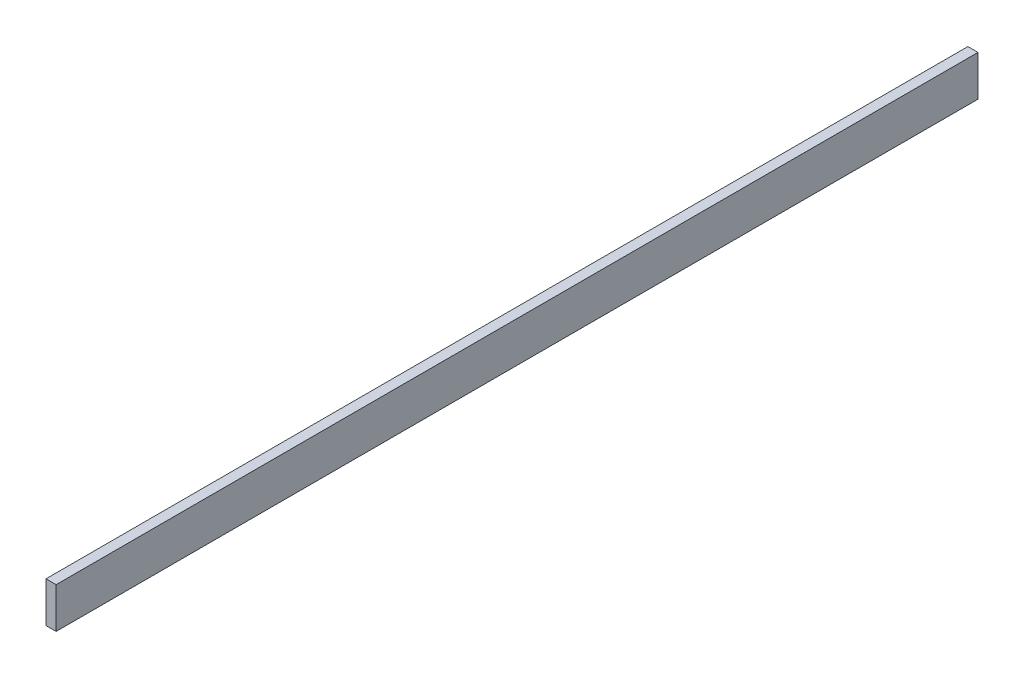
SolidWorks part; units mm, degrees
ref_plane "Front Plane" through (0, 0, 0) normal (0, 0, 1) x (1, 0, 0)
ref_plane "Top Plane" through (0, 0, 0) normal (0, 1, 0) x (1, 0, 0)
ref_plane "Right Plane" through (0, 0, 0) normal (1, 0, 0) x (0, 0, -1)
sketch "Sketch1" plane through (0, 0, 0) normal (0, 0, 1) x (1, 0, 0)
  line L1 (-12.7, -50.8) -> (12.7, -50.8)
  line L2 (-12.7, -50.8) -> (-12.7, 50.8)
  line L3 (-12.7, 50.8) -> (12.7, 50.8)
  line L4 (12.7, -50.8) -> (12.7, 50.8)
  line L5 (-12.7, -50.8) -> (12.7, 50.8) construction
  line L6 (-12.7, 50.8) -> (12.7, -50.8) construction
  point P0 (0, 0)
  dimension "D1" = 25.4
  dimension "D2" = 101.6
extrude "Boss-Extrude1" add sketch "Sketch1" along normal blind 2311.4
